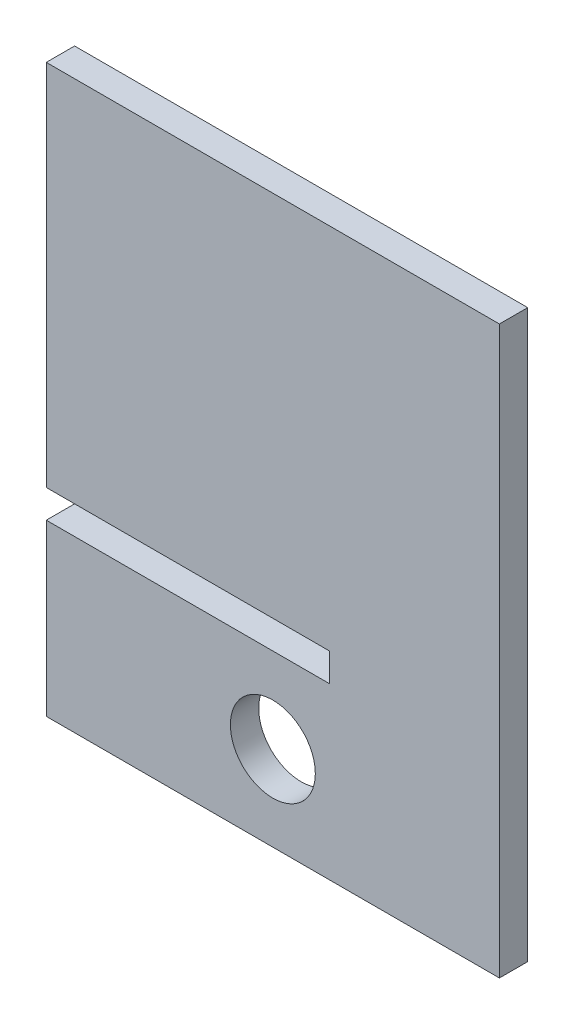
SolidWorks part; units mm, degrees
other "Objet de détail1"
ref_plane "Plan de face" through (0, 0, 0) normal (0, 0, 1) x (1, 0, 0)
ref_plane "Plan de dessus" through (0, 0, 0) normal (0, 1, 0) x (1, 0, 0)
ref_plane "Plan de droite" through (0, 0, 0) normal (1, 0, 0) x (0, 0, -1)
sketch "Esquisse1" plane through (0, 0, 0) normal (0, 0, 1) x (1, 0, 0)
  line L0 (-41.5573, -39.1162) -> (-41.5573, -69.1162)
  line L1 (-41.5573, 30.8838) -> (38.4427, 30.8838)
  line L2 (-41.5573, -34.1162) -> (-41.5573, 30.8838)
  line L3 (-41.5573, -69.1162) -> (38.4427, -69.1162)
  line L4 (38.4427, 30.8838) -> (38.4427, -69.1162)
  line L5 (-41.5573, -34.1162) -> (8.4427, -34.1162)
  line L7 (-41.5573, -39.1162) -> (8.4427, -39.1162)
  line L8 (8.4427, -34.1162) -> (8.4427, -39.1162)
  circle A0 centre (-1.5573, -54.1162) radius 7.5
  dimension "D5" = 15
  dimension "D1" = 80
  dimension "D2" = 100
  dimension "D3" = 50
  dimension "D4" = 5
  dimension "D6" = 40
  dimension "D7" = 15
  dimension "D8" = 30
extrude "Boss.-Extru.1" add sketch "Esquisse1" along normal blind 5
